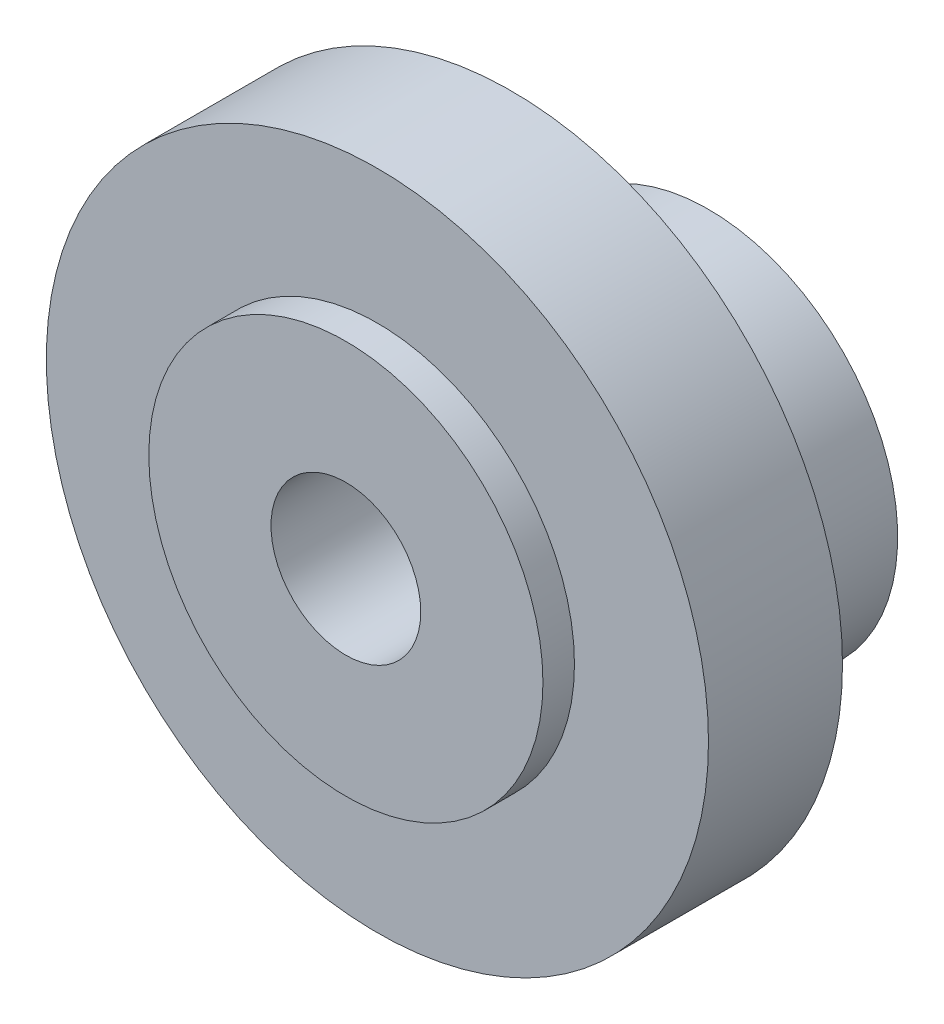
SolidWorks part; units mm, degrees
ref_plane "Plan de face" through (0, 0, 0) normal (0, 0, 1) x (1, 0, 0)
ref_plane "Plan de dessus" through (0, 0, 0) normal (0, 1, 0) x (1, 0, 0)
ref_plane "Plan de droite" through (0, 0, 0) normal (1, 0, 0) x (0, 0, -1)
sketch "Esquisse1" plane through (0, 0, 0) normal (0, 0, 1) x (1, 0, 0)
  circle A0 centre (0, 0) radius 24
extrude "Extrusion1" add sketch "Esquisse1" along normal blind 13
sketch "Esquisse2" plane through (0, 0, 13) normal (0, 0, 1) x (1, 0, 0)
  circle A0 centre (0, 0) radius 28
sketch "Esquisse3" plane through (0, 0, 13) normal (0, 0, 1) x (1, 0, 0)
  circle A0 centre (0, 7.5) radius 25
extrude "Extrusion3" add sketch "Esquisse3" along normal blind 12
extrude "Extrusion4" add sketch "Esquisse2" along normal blind 2
sketch "Esquisse4" plane through (0, 0, 25) normal (0, 0, 1) x (1, 0, 0)
  circle A0 centre (0, 7.5) radius 42
extrude "Extrusion5" add sketch "Esquisse4" along normal blind 17
sketch "Esquisse5" plane through (0, 0, 42) normal (0, 0, 1) x (1, 0, 0)
  circle A0 centre (0, 7.5) radius 25
extrude "Extrusion6" add sketch "Esquisse5" along normal blind 4
sketch "Esquisse6" plane through (0, 0, 46) normal (0, 0, 1) x (1, 0, 0)
  circle A0 centre (0, 7.5) radius 9.5
extrude "Enlèv. mat.-Extru.2" cut sketch "Esquisse6" against normal through all
